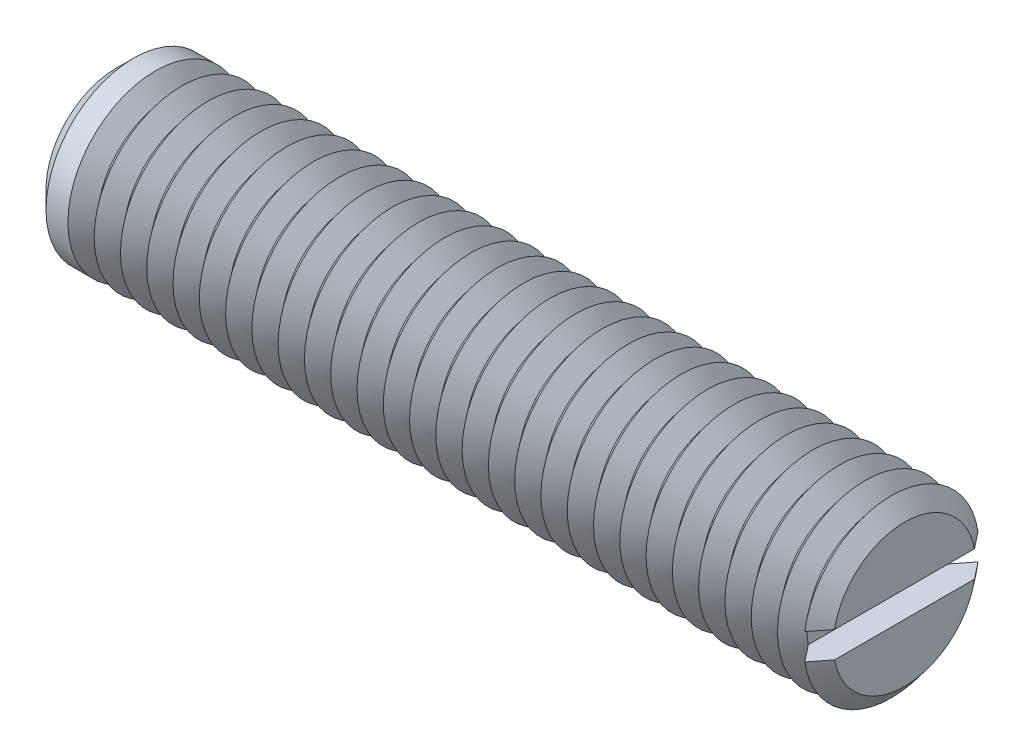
SolidWorks part; units mm, degrees
ref_plane "Front Plane" through (0, 0, 0) normal (0, 0, 1) x (1, 0, 0)
ref_plane "Top Plane" through (0, 0, 0) normal (0, 1, 0) x (1, 0, 0)
ref_plane "Right Plane" through (0, 0, 0) normal (1, 0, 0) x (0, 0, -1)
sketch "Sketch1" plane through (0, 0, 0) normal (1, 0, 0) x (0, 0, -1)
  circle A0 centre (0, 0) radius 5
  dimension "D1" = 10
extrude "Extrude1" add sketch "Sketch1" along normal mid plane 45
sketch "Sketch2" plane through (0, 0, 0) normal (0, 0, 1) x (1, 0, 0)
  line L0 (22.5, 0.75) -> (21, 0.75)
  line L1 (22.5, -5) -> (22.5, 5) construction
  line L2 (21, 0.75) -> (21, -0.75)
  line L3 (0, 0) -> (50000, 0) construction
  line L4 (22.5, -0.75) -> (21, -0.75)
  line L5 (22.5, -0.75) -> (22.5, 0.75)
  point P9 (21, 0)
  dimension "D1" = 1.5
extrude "Extrude2" cut sketch "Sketch2" against normal mid plane 15
chamfer "Chamfer1" distance 1 angle 45 1 edges at (-22.5, 0, -5)
sketch "Sketch3" plane through (0, 0, 0) normal (0, 0, 1) x (1, 0, 0)
  line L0 (0, 0) -> (30.9602, 0) construction
  line L1 (21.75, -5) -> (23.25, -5)
  line L2 (-21.5, -5) -> (22.5, -5) construction
  line L3 (23.25, -5) -> (22.5, -4.0633)
  line L4 (22.5, -5) -> (22.5, -0.75) construction
  line L5 (22.5, -4.0633) -> (21.75, -5)
  dimension "D1" = 1.5
  dimension "D2" = 1.2
revolve "Cut-Revolve1" cut sketch "Sketch3" angle 360 about L0
pattern_linear "LPattern1" count 29 spacing 1.5 along (-1, 0, 0) of "Cut-Revolve1"
equation "\"D2@Sketch3\" = \"D1@Sketch3\"*0.8"
